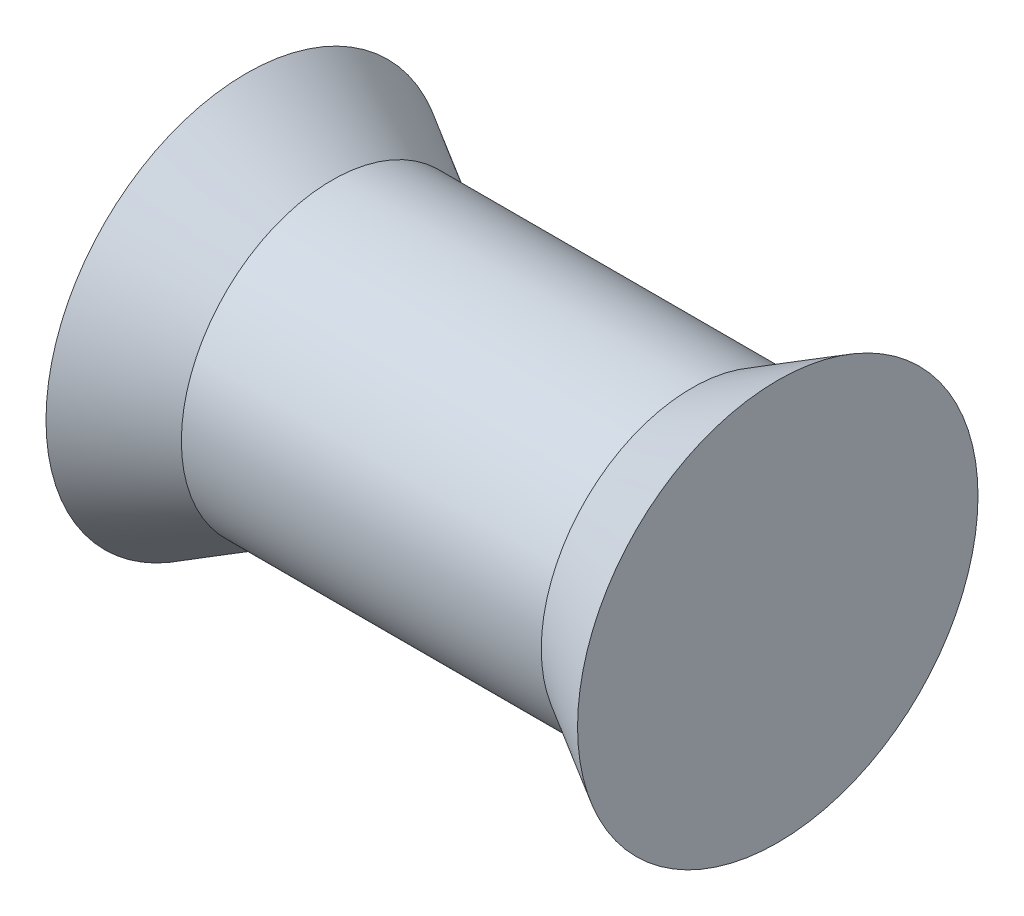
SolidWorks part; units mm, degrees
ref_plane "Спереди" through (0, 0, 0) normal (0, 0, 1) x (1, 0, 0)
ref_plane "Сверху" through (0, 0, 0) normal (0, 1, 0) x (1, 0, 0)
ref_plane "Справа" through (0, 0, 0) normal (1, 0, 0) x (0, 0, -1)
sketch "Эскиз1" plane through (0, 0, 0) normal (0, 0, 1) x (1, 0, 0)
  line L0 (0, 0) -> (-49.4301, 0) construction
  line L1 (0, 0) -> (0, 3.674)
  line L2 (0, 3.674) -> (-1.5748, 2.7648)
  line L3 (-1.5748, 2.7648) -> (-8.1788, 2.7648)
  line L4 (-8.1788, 2.7648) -> (-9.7536, 3.674)
  line L5 (-9.7536, 3.674) -> (-9.7536, 0)
  line L6 (-9.7536, 0) -> (0, 0)
  dimension "D1" = 30
  dimension "D2" = 30
  dimension "D3" = 5.5296
  dimension "D4" = 1.5748
  dimension "D5" = 6.604
revolve "Повернуть1" add sketch "Эскиз1" angle 360 about L0
